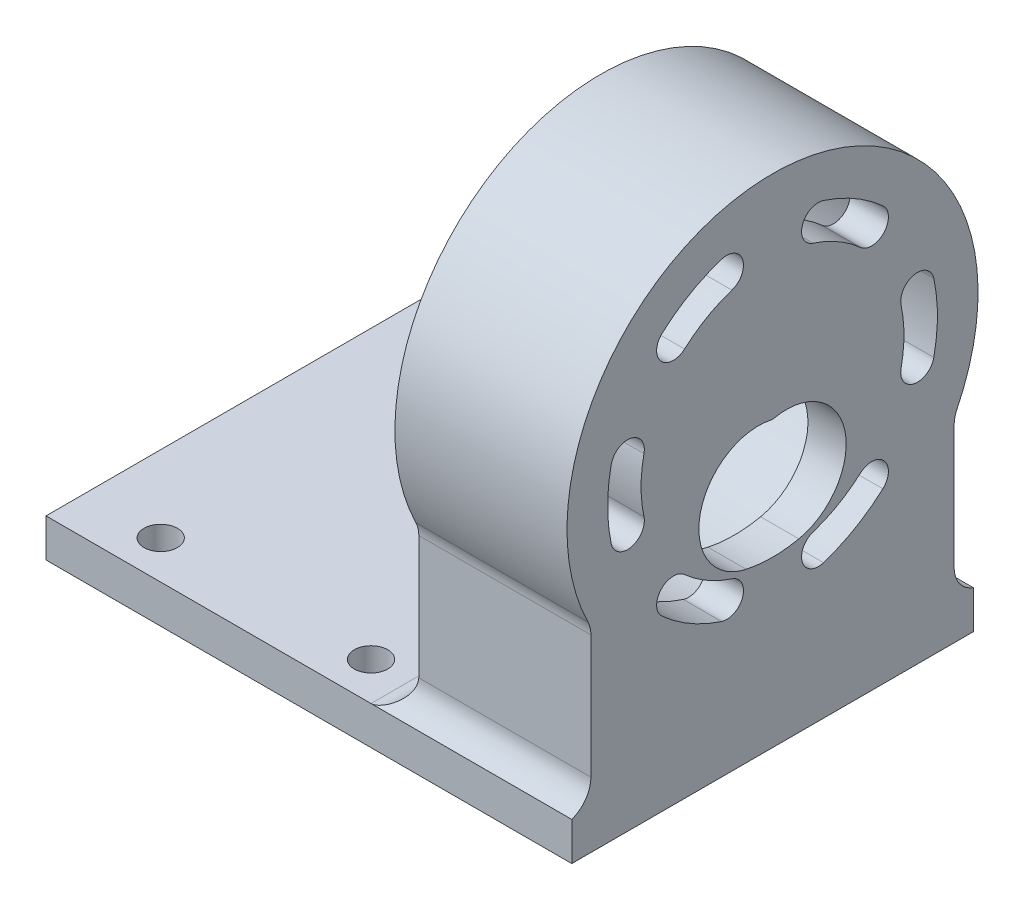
SolidWorks part; units mm, degrees
ref_plane "Plan de face" through (0, 0, 0) normal (0, 0, 1) x (1, 0, 0)
ref_plane "Plan de dessus" through (0, 0, 0) normal (0, 1, 0) x (1, 0, 0)
ref_plane "Plan de droite" through (0, 0, 0) normal (1, 0, 0) x (0, 0, -1)
sketch "Esquisse1" plane through (0, 0, 0) normal (0, 0, 1) x (1, 0, 0)
  line L1 (-27.5, -2) -> (27.5, -2)
  line L2 (-27.5, -2) -> (-27.5, 2)
  line L3 (-27.5, 2) -> (27.5, 2)
  line L4 (27.5, -2) -> (27.5, 2)
  line L5 (-27.5, -2) -> (27.5, 2) construction
  line L6 (-27.5, 2) -> (27.5, -2) construction
  point P0 (0, 0)
  dimension "D1" = 55
  dimension "D2" = 4
extrude "Boss.-Extru.1" add sketch "Esquisse1" along normal mid plane 42
sketch "Esquisse2" plane through (0, 2, 0) normal (0, 1, 0) x (1, 0, 0)
  line L0 (-36.9194, -17) -> (-9.1765, -17) construction
  line L1 (27.5, -21) -> (-27.5, -21) construction
  line L2 (-27.5, -21) -> (-27.5, 21) construction
  circle A0 centre (-19.5, -17) radius 1.75
  circle A1 centre (2.5, -17) radius 1.75
  dimension "D2" = 3.5
  dimension "D4" = 3.5
  dimension "D1" = 4
  dimension "D3" = 8
  dimension "D5" = 22
extrude "Enlèv. mat.-Extru.1" cut sketch "Esquisse2" against normal through all
mirror "Symétrie1" about plane through (0, 0, 0) normal (0, 0, 1) of "Enlèv. mat.-Extru.1"
sketch "Esquisse3" plane through (27.5, 0, 0) normal (1, 0, 0) x (0, 0, -1)
  line L0 (-21, 2) -> (21, 2) construction
  line L1 (-19, 2) -> (-19, 18.4377)
  line L2 (-21, -2) -> (-21, 2) construction
  line L3 (0, 33) -> (0, -6.1149) construction
  line L4 (19, 2) -> (19, 18.4377)
  line L5 (-19, 2) -> (19, 2)
  arc A0 (19, 18.4377) -> (-19, 18.4377) centre (0, 28.5) ccw
  dimension "D1" = 43
  dimension "D2" = 2
  dimension "D3" = 26.5
extrude "Boss.-Extru.2" add sketch "Esquisse3" against normal blind 18
sketch "Esquisse5" plane through (9.5, 0, 0) normal (-1, 0, 0) x (0, 0, 1)
  circle A0 centre (0, 28.5) radius 18.6
  arc A1 (19, 18.4377) -> (-19, 18.4377) centre (0, 28.5) ccw construction
  dimension "D1" = 37.2
extrude "Enlèv. mat.-Extru.2" cut sketch "Esquisse5" against normal blind 14
sketch "Esquisse6" plane through (27.5, 0, 0) normal (1, 0, 0) x (0, 0, -1)
  line L0 (0, 28.5) -> (0, 2.389) construction
  line L1 (0, 28.5) -> (12.1448, 7.4645) construction
  line L2 (0, 28.5) -> (7.4696, 5.5108) construction
  line L3 (0, 28.5) -> (15.2507, 11.5623) construction
  circle A0 centre (0, 28.5) radius 15.5 construction
  arc A1 (19, 18.4377) -> (-19, 18.4377) centre (0, 28.5) ccw construction
  arc A2 (4.249, 15.423) -> (9.2005, 18.2818) centre (0, 28.5) ccw
  arc A3 (5.3305, 12.0943) -> (11.5425, 15.6808) centre (0, 28.5) ccw
  arc A4 (11.5425, 15.6808) -> (9.2005, 18.2818) centre (10.3715, 16.9813) ccw
  arc A5 (4.249, 15.423) -> (5.3305, 12.0943) centre (4.7898, 13.7586) ccw
  dimension "D1" = 31
  dimension "D3" = 27.5
  dimension "D4" = 34.5
  dimension "D7" = 3.5
  dimension "D8" = 3.5
  dimension "D2" = 30
  dimension "D5" = 12
  dimension "D6" = 12
extrude "Enlèv. mat.-Extru.3" cut sketch "Esquisse6" against normal through all
pattern_circular "Répétition circulaire1" count 6 over 360 about axis through (0, 28.5, 0) along (1, 0, 0) of "Enlèv. mat.-Extru.3"
sketch "Esquisse7" plane through (27.5, 0, 0) normal (1, 0, 0) x (0, 0, -1)
  line L0 (-9.5397, 28.5) -> (11.7509, 28.5) construction
  line L1 (0, 25.5117) -> (0, 10.9811) construction
  line L2 (0, 28.5) -> (-4.1517, 8.9679) construction
  line L3 (0, 28.5) -> (4.1728, 8.8684) construction
  circle A0 centre (0, 28.5) radius 7 construction
  arc A1 (19, 18.4377) -> (-19, 18.4377) centre (0, 28.5) ccw construction
  arc A2 (-2.7548, 15.5395) -> (2.7548, 15.5395) centre (0, 28.5) ccw
  arc A3 (-0.1559, 27.7664) -> (0.1559, 27.7664) centre (0, 28.5) ccw
  arc A4 (-0.1559, 27.7664) -> (-2.7548, 15.5395) centre (-1.4554, 21.653) ccw
  arc A5 (2.7548, 15.5395) -> (0.1559, 27.7664) centre (1.4554, 21.653) ccw
  dimension "D1" = 14
  dimension "D2" = 1.5
  dimension "D3" = 26.5
  dimension "D6" = 12.5
  dimension "D7" = 12.5
  dimension "D4" = 12
  dimension "D5" = 12
extrude "Enlèv. mat.-Extru.4" cut sketch "Esquisse7" against normal through all
fillet "Congé1" radius 3 5 edges at (9.5, 2, 0) (18.5, 18.4377, 19) (18.5, 18.4377, -19) (18.5, 2, -19) (18.5, 2, 19)
